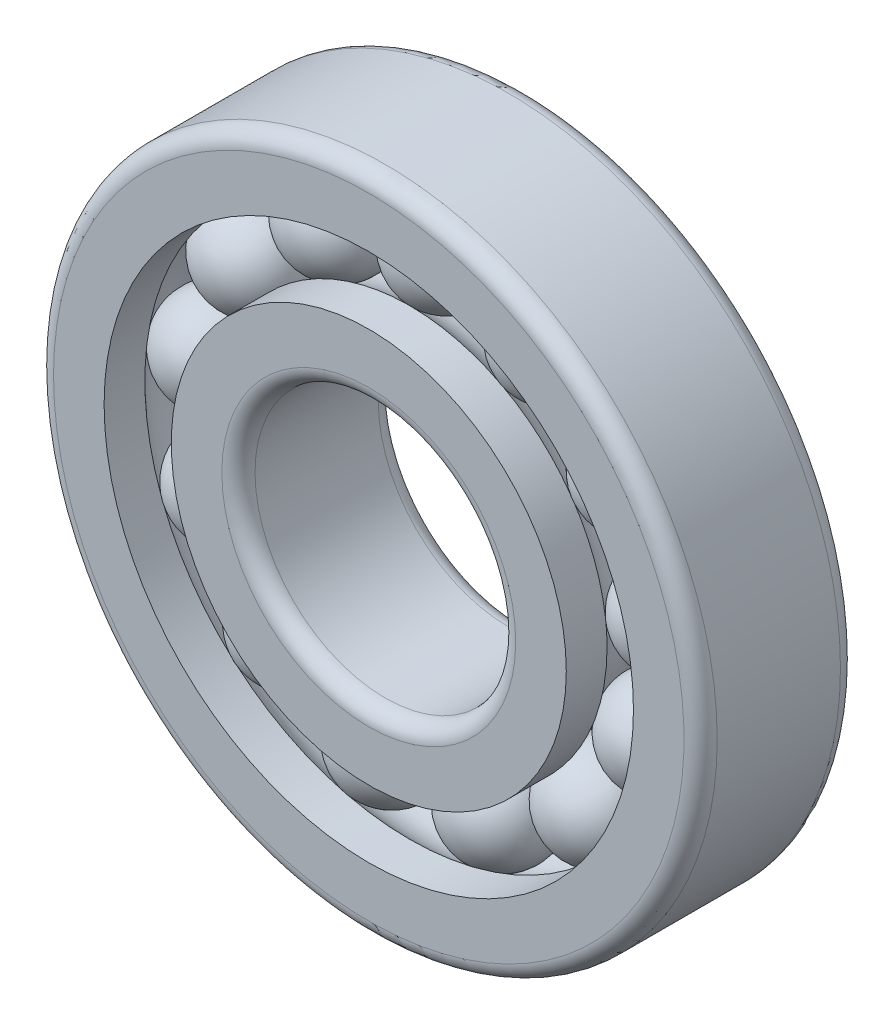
SolidWorks part; units mm, degrees
ref_plane "Front Plane" through (0, 0, 0) normal (0, 0, 1) x (1, 0, 0)
ref_plane "Top Plane" through (0, 0, 0) normal (0, 1, 0) x (1, 0, 0)
ref_plane "Right Plane" through (0, 0, 0) normal (1, 0, 0) x (0, 0, -1)
other "Configuration Table"
sketch "BaseSke" plane through (0, 0, 0) normal (1, 0, 0) x (0, 0, -1)
  line L0 (-47.2296, 0) -> (24.6132, 0) construction
  line L1 (-47.2296, 48.75) -> (24.6132, 48.75) construction
  line L2 (0, 129.5214) -> (0, -86.3012) construction
  line L3 (0, 59.375) -> (0, 38.125)
  line L4 (-16.5, 70) -> (16.5, 70) construction
  line L5 (-16.5, 27.5) -> (16.5, 27.5) construction
  arc A0 (0, 59.375) -> (0, 38.125) centre (0, 48.75) ccw
revolve "Ball" add sketch "BaseSke" angle 360 about L3
sketch "OuterRaceSke" plane through (0, 0, 0) normal (1, 0, 0) x (0, 0, -1)
  line L0 (0, 0) -> (0, 87.5396) construction
  line L1 (-16.5, 70) -> (16.5, 70)
  line L2 (-16.5, 70) -> (-16.5, 55.8333)
  line L3 (-16.5, 55.8333) -> (-7.906, 55.8333)
  line L4 (16.5, 70) -> (16.5, 55.8333)
  line L5 (-50.3916, 0) -> (55.2197, 0) construction
  line L6 (-47.2296, 48.75) -> (24.6132, 48.75) construction
  line L7 (7.906, 55.8333) -> (16.5, 55.8333)
  arc A0 (7.906, 55.8333) -> (-7.906, 55.8333) centre (0, 48.75) ccw
revolve "OuterRace" add sketch "OuterRaceSke" angle 360 about L5
sketch "InnerRaceSke" plane through (0, 0, 0) normal (1, 0, 0) x (0, 0, -1)
  line L0 (-70.8626, 0) -> (113.5527, 0) construction
  line L1 (0, 58.441) -> (0, -70.8113) construction
  line L2 (-16.5, 27.5) -> (16.5, 27.5)
  line L3 (-16.5, 27.5) -> (-16.5, 41.6667)
  line L4 (-16.5, 41.6667) -> (-7.906, 41.6667)
  line L5 (16.5, 27.5) -> (16.5, 41.6667)
  line L6 (0, 129.5214) -> (0, -86.3012) construction
  line L7 (7.906, 41.6667) -> (16.5, 41.6667)
  arc A0 (-7.906, 41.6667) -> (7.906, 41.6667) centre (0, 48.75) ccw
  arc A1 (0, 59.375) -> (0, 38.125) centre (0, 48.75) ccw construction
revolve "InnerRace" add sketch "InnerRaceSke" angle 360 about L0
fillet "Fillet1" radius 3.5 4 edges at (27.5, 0, -16.5) (27.5, 0, 16.5) (70, 0, -16.5) (70, 0, 16.5)
pattern_circular "CirPatternBall" count 13 over 360 about axis through (0, 0, 0) along (0, 0, 1) of "Ball"
sketch "SimplifiedSke" plane through (0, 0, 0) normal (1, 0, 0) x (0, 0, -1)
  line L0 (37.5911, 0) -> (-37.5911, 0) construction
  circle A0 centre (0, 48.75) radius 10.625
  arc A1 (0, 59.375) -> (0, 38.125) centre (0, 48.75) ccw construction
revolve "Simplified" [suppressed] add sketch "SimplifiedSke" angle 360 about L0
equation "\"D1@BaseSke\" =  (\"Bearing_Outside_Diameter@BaseSke\"  +  \"Bearing_Inside_Diameter@BaseSke\"  )  / 4"
equation "\"Ball_diameter@BaseSke\" =  ( \"Bearing_Outside_Diameter@BaseSke\" - \"Bearing_Inside_Diameter@BaseSke\" ) / 4 "
equation "\"D2@OuterRaceSke\" = \"Bearing_Outside_Diameter@BaseSke\" -  ( \"Bearing_Outside_Diameter@BaseSke\" - \"Bearing_Inside_Diameter@BaseSke\" )  / 3"
equation "\"D4@OuterRaceSke\" = (  \"Bearing_Outside_Diameter@BaseSke\" - \"Bearing_Inside_Diameter@BaseSke\" ) / 4 -0.02"
equation "\"D1@InnerRaceSke\" = \"Bearing_Inside_Diameter@BaseSke\" +  ( \"Bearing_Outside_Diameter@BaseSke\" - \"Bearing_Inside_Diameter@BaseSke\" )  / 3"
equation "\"D2@InnerRaceSke\" = \"D4@OuterRaceSke\""
equation "\"D1@CirPatternBall\" = int( \"D1@BaseSke\"* pi  * 2 / \"Ball_diameter@BaseSke\" ) -1"
